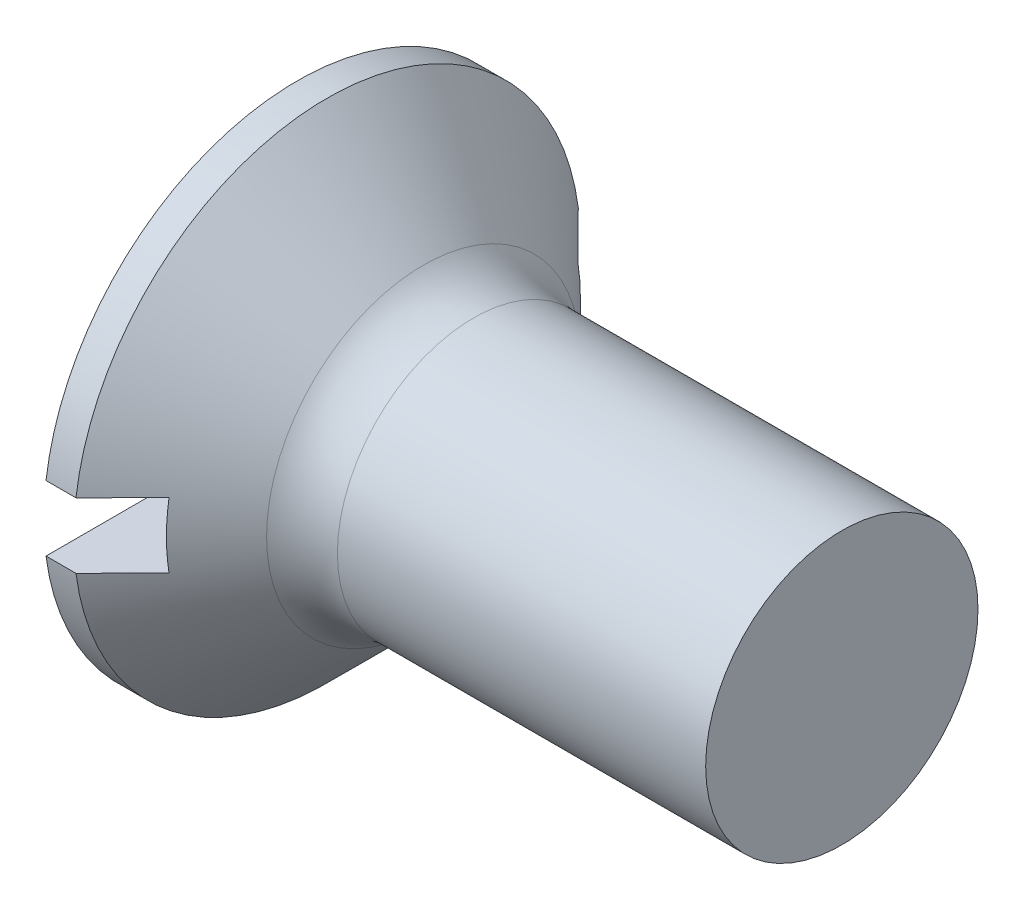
SolidWorks part; units mm, degrees
ref_plane "Plane1" through (0, 0, 0) normal (0, 0, 1) x (1, 0, 0)
ref_plane "Plane2" through (0, 0, 0) normal (0, 1, 0) x (1, 0, 0)
ref_plane "Plane3" through (0, 0, 0) normal (1, 0, 0) x (0, 0, -1)
sketch "BodySke" plane through (0, 0, 0) normal (0, 0, 1) x (1, 0, 0)
  line L0 (0, 0) -> (0, 4.65)
  line L1 (0, 4.65) -> (0.55, 4.65)
  line L2 (2.7, 2.5) -> (10, 2.5)
  line L3 (10, 2.5) -> (10, 0)
  line L4 (10, 0) -> (0, 0)
  line L5 (-6.35, 0) -> (82.55, 0) construction
  line L6 (2.7, -2.5) -> (10, -2.5) construction
  line L7 (0.55, -4.65) -> (2.7, -2.5) construction
  line L8 (0.55, 4.65) -> (2.7, 2.5)
  line L9 (0, -4.65) -> (0.55, -4.65) construction
  line L10 (3.5, 4.0875) -> (3.5, -5.4375) construction
  line L11 (0, 6.35) -> (0, -3.175) construction
  dimension "Diameter" = 5
  dimension "Length" = 10
  dimension "Head_ht" = 2.7
  dimension "Head_dia" = 9.3
  dimension "Head_ang" = 90
  dimension "D6" = 0.55
  dimension "Advance" = 0.8
  dimension "Thread_nom" = 10
revolve "Base-Revolve" add sketch "BodySke" angle 360 about L5
fillet "Fillet1" radius 1.3 1 edges at (2.7, 0, 2.5)
sketch "Sketch2" plane through (0, 0, 0) normal (-1, 0, 0) x (0, 0, 1)
  line L0 (-4.65, -0.6) -> (4.65, -0.6)
  line L1 (-4.65, -0.6) -> (-4.65, 0.6)
  line L2 (4.65, 0.6) -> (-4.65, 0.6)
  line L3 (4.65, 0.6) -> (4.65, -0.6)
  dimension "D1" = 0.6
  dimension "Slot_width" = 1.2
  dimension "D2" = 9.3
  dimension "D3" = 4.65
extrude "Slot" cut sketch "Sketch2" against normal blind 1.4
sketch "ThdSchSke" plane through (0, 0, 0) normal (0, 0, 1) x (1, 0, 0)
  line L0 (3.5, -2.055) -> (3.1884, -2.5)
  line L1 (3.5, -2.055) -> (3.8116, -2.5)
  line L2 (3.8116, -2.5) -> (3.8116, -3.125)
  line L3 (-3.175, 0) -> (5.1513, 0) construction
  line L5 (3.8116, -3.125) -> (3.1884, -3.125)
  line L6 (3.1884, -3.125) -> (3.1884, -2.5)
  line L7 (0, 4.65) -> (0, 0.6) construction
  dimension "Thread_minor" = 4.11
  dimension "Diameter" = 5
  dimension "Start" = 3.5
  dimension "SideAngle" = 55
  dimension "VeeAngle" = 70
  dimension "Overcut" = 6.25
revolve "ThreadSchematic" [suppressed] cut sketch "ThdSchSke" angle 360 about L3
pattern_linear "ThdSchPat" [suppressed]
equation "\"D1@Sketch2\" = \"Slot_width@Sketch2\" / 2"
equation "\"D2@Sketch2\" = \"Head_dia@BodySke\""
equation "\"D3@Sketch2\" = \"D2@Sketch2\" / 2"
equation "\"Thread_length@ThreadCosmetic\" = ((sgn( (\"Length@BodySke\" - \"Advance@BodySke\" * 1.0 - \"Head_ht@BodySke\" ) - \"Thread_nom@BodySke\" )-1)*( (\"Length@BodySke\" - \"Advance@BodySke\" * 1.0 - \"Head_ht@BodySke\" "
equation "\"Thread_minor@ThdSchSke\" = \"Thread_minor@ThreadCosmetic\""
equation "\"Diameter@ThdSchSke\" = \"Diameter@BodySke\""
equation "\"Overcut@ThdSchSke\" = \"Diameter@BodySke\" * 1.25"
equation "\"Start@ThdSchSke\" = 0.000001 + \"Length@BodySke\" - \"Thread_length@ThreadCosmetic\"  '---Countersunk---"
equation "\"Num_threads@ThdSchPat\" = int( \"Thread_length@ThreadCosmetic\" / \"Advance@BodySke\" + 0.999 )  + 1"
equation "\"Advance@ThdSchPat\" = \"Thread_length@ThreadCosmetic\" /  (\"Num_threads@ThdSchPat\" - 1) 'relax it"
